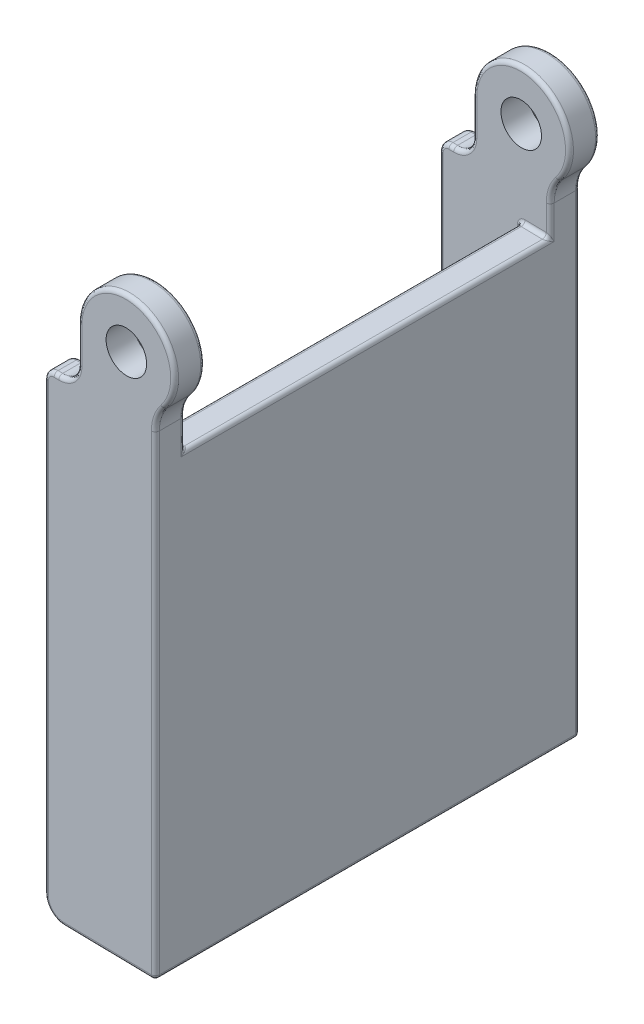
SolidWorks part; units mm, degrees
ref_plane "Plan de face" through (0, 0, 0) normal (0, 0, 1) x (1, 0, 0)
ref_plane "Plan de dessus" through (0, 0, 0) normal (0, 1, 0) x (1, 0, 0)
ref_plane "Plan de droite" through (0, 0, 0) normal (1, 0, 0) x (0, 0, -1)
sketch "Esquisse1" plane through (0, 0, 0) normal (0, 0, 1) x (1, 0, 0)
  line L0 (145.5999, 74.5046) -> (145.5999, 50.833)
  line L1 (145.5999, 50.833) -> (151.3415, 50.833)
  line L2 (151.3415, 75.0046) -> (151.3415, 50.833)
  line L4 (147.3415, 77.833) -> (147.3415, 76.0046)
  line L5 (146.3415, 75.0046) -> (146.0999, 75.0046)
  arc A0 (151.3415, 75.0046) -> (151.7859, 76.2617) centre (153.3415, 75.0046) cw
  arc A1 (151.7859, 76.2617) -> (147.3415, 77.833) centre (149.8415, 77.833) ccw
  arc A2 (147.3415, 76.0046) -> (146.3415, 75.0046) centre (146.3415, 76.0046) cw
  arc A3 (145.5999, 74.5046) -> (146.0999, 75.0046) centre (146.0999, 74.5046) cw
  dimension "D3" = 2
  dimension "D4" = 1
  dimension "D5" = 0.5
  dimension "D2" = 1.5
extrude "Extrusion1" add sketch "Esquisse1" against normal blind 1.5
sketch "Esquisse2" plane through (0, 0, -1.5) normal (0, 0, -1) x (-1, 0, 0)
  line L0 (-145.5999, 50.833) -> (-151.3415, 50.833) construction
  line L1 (-151.3415, 73.5046) -> (-149.8415, 73.5046)
  line L2 (-151.3415, 73.5046) -> (-151.3415, 50.833)
  line L3 (-151.3415, 50.833) -> (-149.8415, 50.833)
  line L4 (-149.8415, 73.5046) -> (-149.8415, 50.833)
extrude "Extrusion2" add sketch "Esquisse2" along normal blind 18.6
sketch "Esquisse3" plane through (0, 0, -20.1) normal (0, 0, -1) x (-1, 0, 0)
  line L5 (-146.0999, 75.0046) -> (-146.3415, 75.0046)
  line L6 (-147.3415, 76.0046) -> (-147.3415, 77.833)
  line L7 (-151.3415, 75.0046) -> (-151.3415, 50.833)
  line L8 (-151.3415, 50.833) -> (-145.5999, 50.833)
  line L9 (-145.5999, 50.833) -> (-145.5999, 74.5046)
  line L10 (-146.0999, 75.0046) -> (-146.3415, 75.0046)
  line L11 (-147.3415, 76.0046) -> (-147.3415, 77.833)
  line L12 (-151.3415, 75.0046) -> (-151.3415, 50.833)
  line L13 (-151.3415, 50.833) -> (-145.5999, 50.833)
  line L14 (-145.5999, 50.833) -> (-145.5999, 74.5046)
  arc A4 (-147.3415, 76.0046) -> (-146.3415, 75.0046) centre (-146.3415, 76.0046) ccw
  arc A5 (-147.3415, 77.833) -> (-151.7859, 76.2617) centre (-149.8415, 77.833) ccw
  arc A6 (-151.3415, 75.0046) -> (-151.7859, 76.2617) centre (-153.3415, 75.0046) ccw
  arc A7 (-145.5999, 74.5046) -> (-146.0999, 75.0046) centre (-146.0999, 74.5046) ccw
  arc A8 (-147.3415, 76.0046) -> (-146.3415, 75.0046) centre (-146.3415, 76.0046) ccw
  arc A9 (-147.3415, 77.833) -> (-151.7859, 76.2617) centre (-149.8415, 77.833) ccw
  arc A10 (-151.3415, 75.0046) -> (-151.7859, 76.2617) centre (-153.3415, 75.0046) ccw
  arc A11 (-145.5999, 74.5046) -> (-146.0999, 75.0046) centre (-146.0999, 74.5046) ccw
  dimension "D1" = 0
extrude "Extrusion3" add sketch "Esquisse3" along normal blind 1.5
sketch "Esquisse4" plane through (0, 0, 0) normal (0, 0, 1) x (1, 0, 0)
  circle A0 centre (149.8415, 77.833) radius 1.05
extrude "Enlèv. mat.-Extru.1" cut sketch "Esquisse4" against normal through all
draft "Dépouille1" type of draft neutral plane draft angle 1 faces to draft 1 parameters "D1"=1
draft "Dépouille2" type of draft neutral plane draft angle 1 faces to draft 1 parameters "D1"=1
draft "Dépouille3" type of draft neutral plane draft angle 1 faces to draft 1 parameters "D1"=1
draft "Dépouille4" type of draft neutral plane draft angle 1 faces to draft 1 parameters "D1"=1
fillet "Congé3" radius 0.2 1 edges at (151.3415, 50.833, -10.8)
fillet "Congé7" radius 0.2 2 edges at (149.8415, 62.1688, -1.4738) (149.8415, 62.1688, -20.1262)
fillet "Congé8" radius 0.2 4 edges at (149.7841, 73.5046, -20.0698) (149.7841, 73.5046, -1.5302) (149.8415, 73.5046, -10.8) (151.3415, 73.5046, -10.8)
fillet "Congé11" radius 1 2 edges at (145.5999, 50.833, -0.75) (145.5999, 50.833, -20.85)
fillet "Congé12" radius 0.2 45 edges at (151.3415, 74.1546, -1.5) (151.4558, 75.6713, -1.502) (150.6748, 80.1901, -1.4884) (147.3415, 76.9188, -1.4302) (147.0486, 75.2975, -1.4251) (146.2207, 75.0046, -1.4106) (145.7464, 74.8582, -1.4023) (145.5999, 63.1688, -1.3998) (145.8928, 51.1259, -1.4049) (148.1224, 50.833, -1.4438) (149.7841, 50.833, -1.5302) (149.8415, 50.833, -10.8) (149.7841, 50.833, -20.0698) (148.1224, 50.833, -20.1562) (145.8928, 51.1259, -20.1951) (151.3415, 74.1546, -20.1) (151.4558, 75.6713, -20.098) (150.6748, 80.1901, -20.1116) (147.3415, 76.9188, -20.1698) (147.0486, 75.2975, -20.1749) (146.2207, 75.0046, -20.1894) (145.7464, 74.8582, -20.1977) (145.7464, 74.8582, -0.0977) (146.2207, 75.0046, -0.0894) (147.0486, 75.2975, -0.0749) (147.3415, 76.9188, -0.0698) (150.6748, 80.1901, -0.0116) (151.4558, 75.6713, 0.002) (151.3415, 63.0188, 0) (151.2829, 50.8916, -0.001) (148.8707, 50.833, -0.0431) (145.8928, 51.1259, -0.0951) (145.8928, 51.1259, -21.5049) (148.8707, 50.833, -21.5569) (151.2829, 50.8916, -21.599) (151.3415, 63.0188, -21.6) (151.4558, 75.6713, -21.602) (150.6748, 80.1901, -21.5884) (147.3415, 76.9188, -21.5302) (147.0486, 75.2975, -21.5251) (146.2207, 75.0046, -21.5106) (145.7464, 74.8582, -21.5023) (145.5999, 63.1688, -20.2002) (145.5999, 63.1688, -0.1002) (145.5999, 63.1688, -21.4998)
fillet "Congé13" radius 0.2 4 edges at (149.8913, 73.4867, -20.1253) (151.2829, 73.446, -20.1621) (151.1397, 73.5046, -20.1035) (150.5646, 73.5046, -20.1136)
fillet "Congé14" radius 0.2 4 edges at (149.8913, 73.4867, -1.4747) (151.2829, 73.446, -1.4379) (151.1397, 73.5046, -1.4965) (150.5646, 73.5046, -1.4864)
